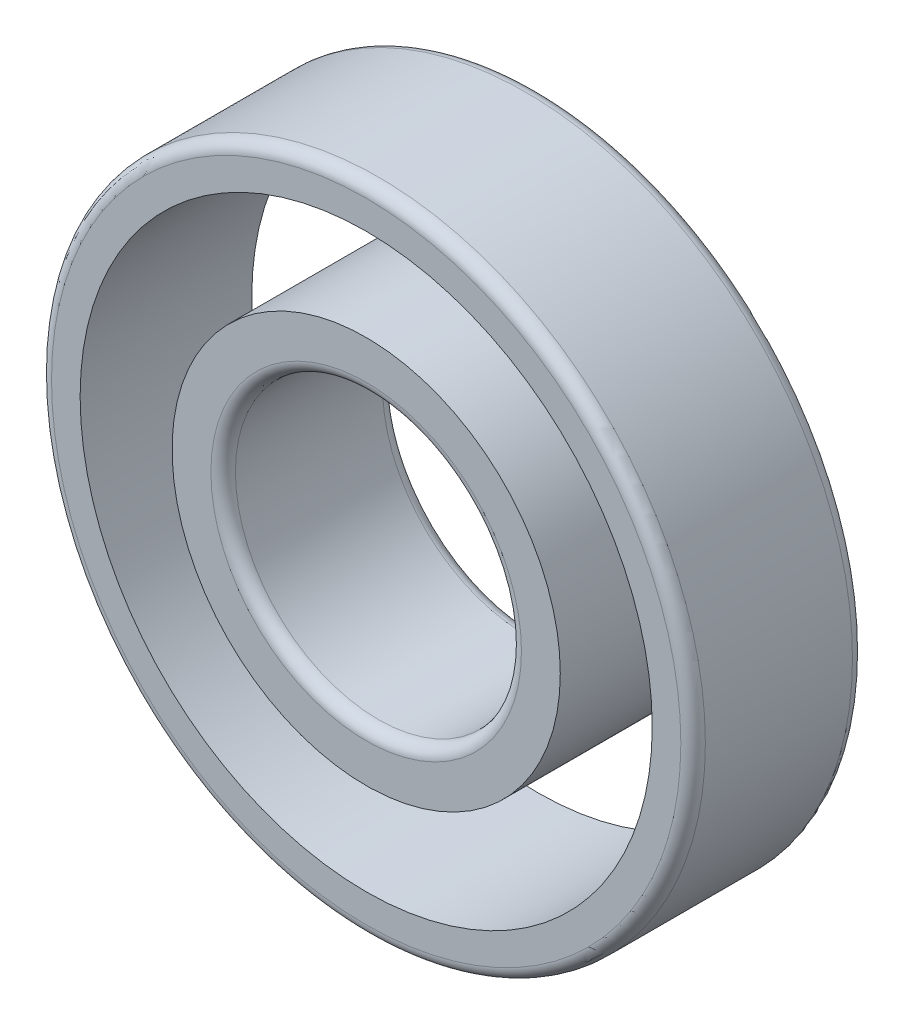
SolidWorks part; units mm, degrees
ref_plane "前视基准面" through (0, 0, 0) normal (0, 0, 1) x (1, 0, 0)
ref_plane "上视基准面" through (0, 0, 0) normal (0, 1, 0) x (1, 0, 0)
ref_plane "右视基准面" through (0, 0, 0) normal (1, 0, 0) x (0, 0, -1)
sketch "草图1" plane through (0, 0, 0) normal (1, 0, 0) x (0, 0, -1)
  line L0 (0, 0) -> (46.9722, 0) construction
  line L1 (0, 17.5) -> (21, 17.5)
  line L2 (21, 17.5) -> (21, 23.75)
  line L3 (21, 23.75) -> (0, 23.75)
  line L4 (0, 23.75) -> (0, 17.5)
  line L5 (0, 35) -> (0, 40)
  line L6 (0, 40) -> (21, 40)
  line L7 (21, 40) -> (21, 35)
  line L8 (21, 35) -> (0, 35)
  dimension "D1" = 35
  dimension "D2" = 40
  dimension "D3" = 11.25
  dimension "D4" = 21
  dimension "D5" = 35
revolve "旋转1" add sketch "草图1" angle 360 about L0
fillet "圆角1" radius 1.5 2 edges at (40, 0, -21) (40, 0, 0)
fillet "圆角2" radius 1.5 2 edges at (17.5, 0, -21) (17.5, 0, 0)
